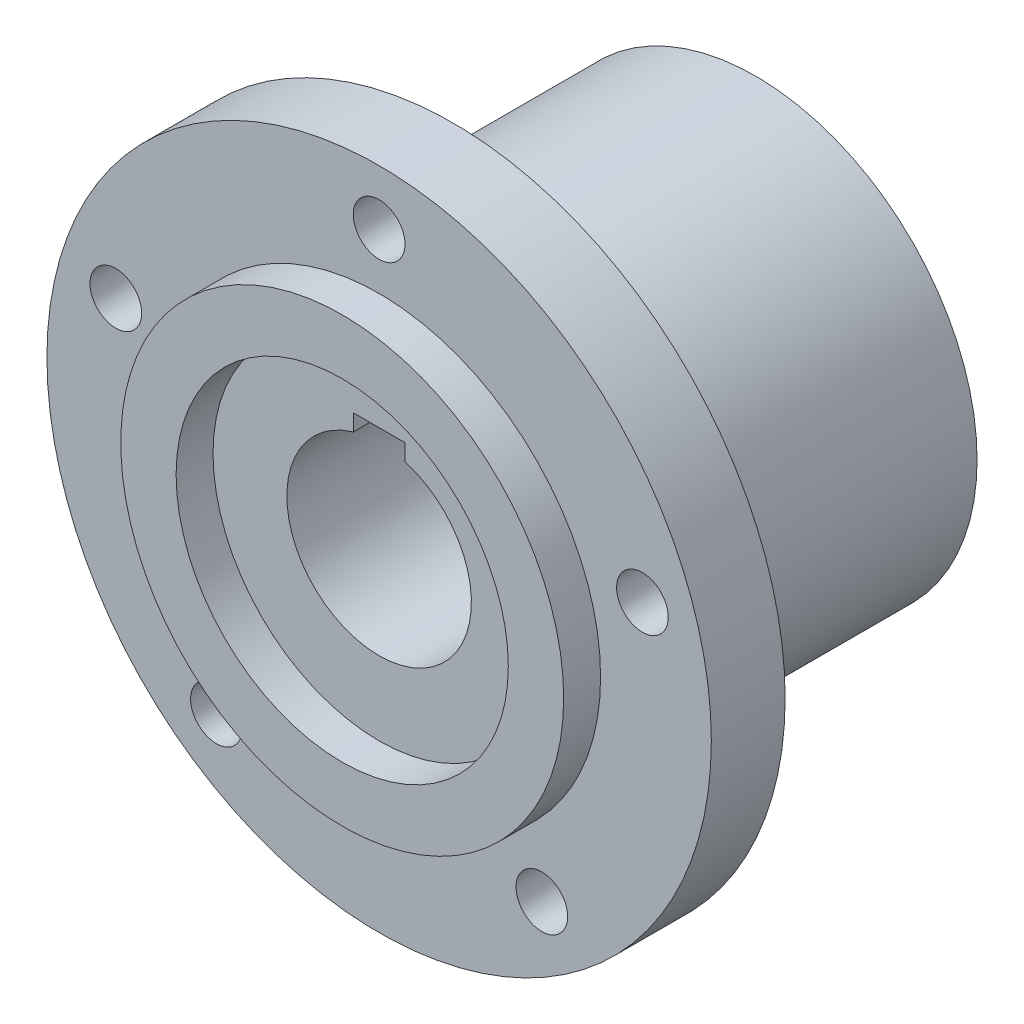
SolidWorks part; units mm, degrees
ref_plane "Face" through (0, 0, 0) normal (0, 0, 1) x (1, 0, 0)
ref_plane "Dessus" through (0, 0, 0) normal (0, 1, 0) x (1, 0, 0)
ref_plane "Droite" through (0, 0, 0) normal (1, 0, 0) x (0, 0, -1)
sketch "Esquisse1" plane through (0, 0, 0) normal (0, 0, 1) x (1, 0, 0)
  circle A0 centre (0, 0) radius 60
  dimension "D1" = 120
extrude "Extrusion1" add sketch "Esquisse1" along normal mid plane 102
sketch "Esquisse2" plane through (0, 0, 51) normal (0, 0, 1) x (1, 0, 0)
  line L1 (7, 28.5) -> (-7, 28.5)
  line L2 (7, 28.5) -> (7, 24)
  line L4 (-7, 28.5) -> (-7, 24)
  arc A0 (-7, 24) -> (7, 24) centre (0, 0) ccw
  dimension "D1" = 50
  dimension "D2" = 14
  dimension "D3" = 7
  dimension "D4" = 28.5
extrude "Enlèv. mat.-Extru.1" cut sketch "Esquisse2" against normal through all
ref_plane "Plan1" through (0, 0, 51) normal (0, 0, 1) x (1, 0, 0)
sketch "Esquisse3" plane through (0, 0, 51) normal (0, 0, 1) x (1, 0, 0)
  circle A0 centre (0, 0) radius 90
  circle A1 centre (0, 0) radius 60 construction
  circle A2 centre (0, 0) radius 60
  dimension "D1" = 30
extrude "Extrusion2" add sketch "Esquisse3" against normal blind 20
hole_wizard "Trou taraudé M16x2" positions "Esquisse6" profile "Esquisse7" tap size "M16x2.0" standard "ISO"
sketch "Esquisse6" plane through (0, 0, 51) normal (0, 0, 1) x (1, 0, 0)
  line L0 (0, 0) -> (0, 100.1144) construction
  point P0 (0, 75)
  dimension "D1" = 75
sketch "Esquisse7" plane through (0, 75, 51) normal (1, 0, 0) x (0, -1, 0)
  line L0 (0, 0) -> (0, 102)
  line L1 (0, 102) -> (7, 102)
  line L2 (7, 102) -> (7, 0)
  line L5 (7, 0) -> (0, 0)
  line L11 (0, -6.35) -> (0, 107.95) construction
  dimension "Diamètre du trou pour taraudage jusqu'au prochain" = 14
  dimension "Profondeur du trou pour taraudage jusqu'au prochain" = 102
pattern_circular "Répétition circulaire1" count 5 every 72 about axis through (0, 0, 0) along (0, 0, 1) of "Trou taraudé M16x2"
sketch "Esquisse8" plane through (0, 0, 51) normal (0, 0, 1) x (1, 0, 0)
  circle A0 centre (0, 0) radius 45
  circle A1 centre (0, 0) radius 60
  dimension "D1" = 90
  dimension "D2" = 120
extrude "Extrusion3" add sketch "Esquisse8" along normal blind 10
